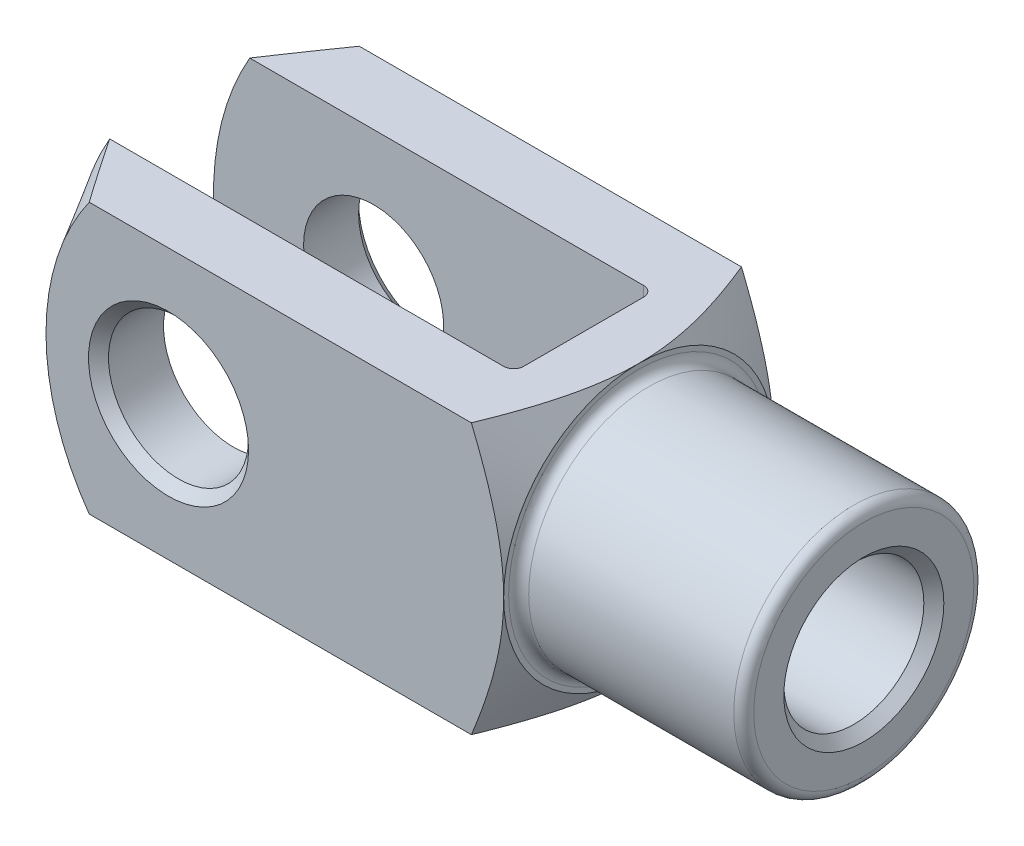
SolidWorks part; units mm, degrees
ref_plane "Front Plane" through (0, 0, 0) normal (0, 0, 1) x (1, 0, 0)
ref_plane "Top Plane" through (0, 0, 0) normal (0, 1, 0) x (1, 0, 0)
ref_plane "Right Plane" through (0, 0, 0) normal (1, 0, 0) x (0, 0, -1)
sketch "Sketch1" plane through (0, 0, 0) normal (1, 0, 0) x (0, 0, -1)
  line L0 (0, 0) -> (0, 50000) construction
  line L1 (0, 0) -> (50000, 0) construction
  line L2 (-13.5, -13.5) -> (-13.5, 13.5)
  line L3 (-13.5, 13.5) -> (13.5, 13.5)
  line L4 (13.5, -13.5) -> (13.5, 13.5)
  line L5 (-13.5, -13.5) -> (13.5, -13.5)
  point P9 (0, 13.5)
  point P11 (13.5, 0)
  point P12 (-13.5, 0)
  dimension "D1" = 27
  dimension "D2" = 27
extrude "Extrude1" add sketch "Sketch1" against normal blind 72
sketch "Sketch2" plane through (0, 0, 0) normal (1, 0, 0) x (0, 0, -1)
  circle A0 centre (0, 0) radius 12
  circle A1 centre (0, 0) radius 24
  dimension "D1" = 24
  dimension "D2" = 48
extrude "Extrude2" cut sketch "Sketch2" against normal blind 22.5
sketch "Sketch3" plane through (0, 0, 13.5) normal (0, 0, 1) x (1, 0, 0)
  circle A0 centre (-56, 0) radius 7
  dimension "D1" = 14
  dimension "D2" = 56
extrude "Extrude3" cut sketch "Sketch3" against normal through all
sketch "Sketch4" plane through (0, 13.5, 0) normal (0, 1, 0) x (1, 0, 0)
  line L0 (0, 0) -> (-50000, 0) construction
  line L1 (-72, -7) -> (-72, 7)
  line L2 (-72, 13.5) -> (-72, -13.5) construction
  line L3 (-72, 7) -> (-28, 7)
  line L4 (-28, 7) -> (-28, -7)
  line L5 (-56, 13.5) -> (-56, -13.5) construction
  line L6 (-72, -7) -> (-28, -7)
  point P7 (-56, 0)
  point P13 (-28, 0)
  point P14 (-72, 0)
  dimension "D1" = 28
  dimension "D2" = 14
extrude "Extrude4" cut sketch "Sketch4" against normal through all
fillet "Fillet1" radius 1 2 edges at (-28, 0, 7) (-28, 0, -7)
fillet "Fillet2" radius 1 2 edges at (0, 0, -12) (-22.5, 0, -12)
chamfer "Chamfer2" distance 1 angle 45 2 edges at (-49, 0, -13.5) (-49, 0, 13.5)
sketch "Sketch6" plane through (0, 0, 0) normal (0, 0, 1) x (1, 0, 0)
  line L0 (-22.5, -13.5) -> (-22.5, -27)
  line L1 (-22.5, -27) -> (-30.2942, -27)
  line L2 (-30.2942, -27) -> (-22.5, -13.5)
  dimension "D1" = 30
  dimension "D2" = 27
revolve "Cut-Revolve1" cut sketch "Sketch6" angle 360 about axis through (-22.5, 0, 0) along (1, 0, 0)
sketch "Sketch7" plane through (0, 0, 0) normal (0, 1, 0) x (1, 0, 0)
  line L0 (-68.2472, -13.5) -> (-72, -7)
  line L1 (-72, 7) -> (-68.2472, 13.5)
  line L2 (-68.2472, 13.5) -> (-99, 13.5)
  line L3 (-72, 7) -> (-72, -7)
  line L4 (-99, 13.5) -> (-99, -13.5)
  line L5 (-99, -13.5) -> (-68.2472, -13.5)
  line L6 (-72, 13.5) -> (-25.7285, 13.5) construction
  line L7 (-72, -13.5) -> (-25.7285, -13.5) construction
  line L8 (-45, 0.6162) -> (-45, 50000.6162) construction
  dimension "D1" = 120
  dimension "D2" = 27
  dimension "D3" = 27
revolve "Cut-Revolve2" cut sketch "Sketch7" angle 180 about L8
sketch "Sketch8" plane through (0, 0, 0) normal (1, 0, 0) x (0, 0, -1)
  circle A0 centre (0, 0) radius 7
  dimension "D1" = 14
extrude "Extrude5" cut sketch "Sketch8" against normal through all
chamfer "Chamfer3" distance 1 angle 45 1 edges at (0, 0, -7)
equation "\"D2@Sketch1\" = \"D1@Sketch1\""
equation "\"D2@Sketch2\" = \"D1@Sketch2\"*2"
equation "\"D2@Sketch6\" = \"D1@Sketch1\""
equation "\"D2@Sketch7\" = \"D1@Sketch1\""
equation "\"D3@Sketch7\" = \"D1@Sketch1\""
